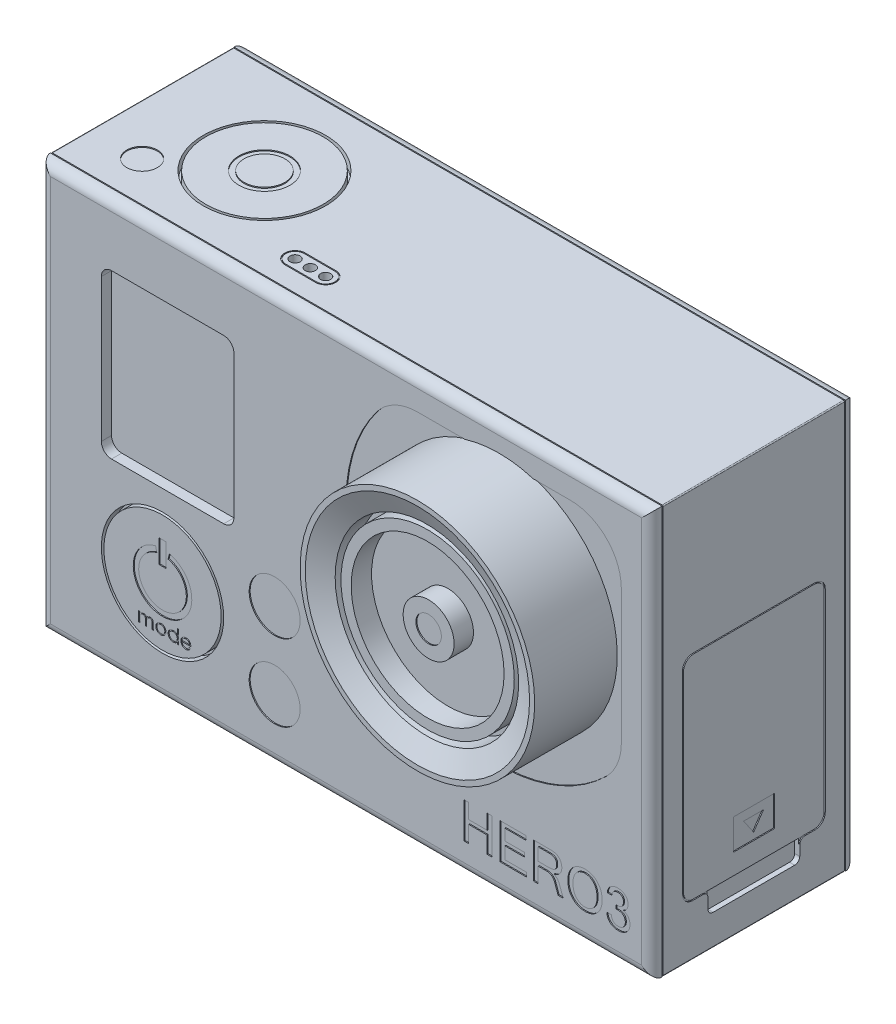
SolidWorks part; units mm, degrees
ref_plane "Plan de face" through (0, 0, 0) normal (0, 0, 1) x (1, 0, 0)
ref_plane "Plan de dessus" through (0, 0, 0) normal (0, 1, 0) x (1, 0, 0)
ref_plane "Plan de droite" through (0, 0, 0) normal (1, 0, 0) x (0, 0, -1)
sketch "Esquisse1" plane through (0, 0, 0) normal (0, 0, 1) x (1, 0, 0)
  line L1 (0, 0) -> (60, 0)
  line L2 (0, 0) -> (0, 40)
  line L3 (0, 40) -> (60, 40)
  line L4 (60, 0) -> (60, 40)
  dimension "D1" = 60
  dimension "D2" = 40
extrude "Extrusion1" add sketch "Esquisse1" along normal blind 20
sketch "Esquisse2" plane through (0, 0, 20) normal (0, 0, 1) x (1, 0, 0)
  line L0 (60, 0) -> (60, 40) construction
  line L1 (60, 0) -> (60, 40) construction
  line L2 (60, 40) -> (0, 40) construction
  circle A0 centre (45, 26) radius 11.5
  dimension "D1" = 23
  dimension "D2" = 15
  dimension "D3" = 14
extrude "Extrusion2" add sketch "Esquisse2" along normal blind 8
sketch "Esquisse3" plane through (0, 0, 20) normal (0, 0, 1) x (1, 0, 0)
  line L0 (0, 40) -> (0, 0) construction
  line L1 (6, 34) -> (19, 34)
  line L2 (6, 34) -> (6, 18)
  line L3 (6, 18) -> (19, 18)
  line L4 (19, 34) -> (19, 18)
  line L5 (60, 40) -> (0, 40) construction
  dimension "D1" = 13
  dimension "D2" = 16
  dimension "D3" = 6
  dimension "D4" = 6
extrude "Enlèv. mat.-Extru.1" cut sketch "Esquisse3" against normal blind 1
sketch "Esquisse4" plane through (0, 0, 20) normal (0, 0, 1) x (1, 0, 0)
  line L0 (0, 40) -> (0, 0) construction
  line L1 (0, 0) -> (60, 0) construction
  circle A0 centre (12, 10) radius 6
  circle A1 centre (12, 10) radius 5.75
  dimension "D1" = 12
  dimension "D2" = 11.5
  dimension "D3" = 12
  dimension "D4" = 10
extrude "Enlèv. mat.-Extru.2" cut sketch "Esquisse4" against normal blind 1
sketch "Esquisse5" plane through (0, 0, 20) normal (0, 0, 1) x (1, 0, 0)
  line L0 (0, 0) -> (60, 0) construction
  line L1 (0, 40) -> (0, 0) construction
  circle A0 centre (23, 13.5) radius 2.5
  circle A1 centre (23, 6) radius 2.5
  dimension "D1" = 5
  dimension "D2" = 5
  dimension "D4" = 23
  dimension "D6" = 7.5
  dimension "D3" = 6
  dimension "D5" = 23
extrude "Enlèv. mat.-Extru.3" cut sketch "Esquisse5" against normal blind 0.1
sketch "Esquisse6" plane through (0, 40, 0) normal (0, 1, 0) x (-1, 0, 0)
  line L0 (0, 20) -> (0, 0) construction
  line L1 (-60, 20) -> (0, 20) construction
  circle A0 centre (-12, 10) radius 5.75
  circle A1 centre (-12, 10) radius 6
  dimension "D1" = 11.5
  dimension "D2" = 12
  dimension "D3" = 12
  dimension "D4" = 10
extrude "Enlèv. mat.-Extru.4" cut sketch "Esquisse6" against normal blind 1
sketch "Esquisse7" plane through (0, 40, 0) normal (0, 1, 0) x (-1, 0, 0)
  circle A0 centre (-12, 10) radius 2.5
  circle A1 centre (-12, 10) radius 2
  dimension "D1" = 5
  dimension "D2" = 4
extrude "Enlèv. mat.-Extru.5" cut sketch "Esquisse7" against normal blind 0.1
sketch "Esquisse8" plane through (0, 0, 20) normal (0, 0, 1) x (1, 0, 0)
  line L0 (57, 37) -> (57, 17)
  line L1 (57, 37) -> (48.3541, 37)
  line L2 (60, 40) -> (0, 40) construction
  line L3 (60, 0) -> (60, 40) construction
  line L4 (41.6459, 37) -> (34.802, 37)
  arc A0 (34.802, 37) -> (57, 17) centre (45, 26) ccw
  circle A1 centre (45, 26) radius 11.5 construction
  arc A3 (41.6459, 37) -> (48.3541, 37) centre (45, 26) ccw
  dimension "D3" = 15
  dimension "D1" = 3
  dimension "D2" = 3
extrude "Enlèv. mat.-Extru.7" cut sketch "Esquisse8" against normal blind 0.1
sketch "Esquisse9" plane through (0, 0, 0) normal (-1, 0, 0) x (0, 0, 1)
  line L0 (0, 40) -> (0, 0) construction
  line L1 (20, 0) -> (0, 0) construction
  circle A0 centre (10, 10) radius 2.5
  circle A1 centre (10, 10) radius 2.25
  dimension "D1" = 5
  dimension "D2" = 4.5
  dimension "D3" = 10
  dimension "D4" = 10
extrude "Enlèv. mat.-Extru.8" cut sketch "Esquisse9" against normal blind 0.1
sketch "Esquisse10" plane through (0, 0, 0) normal (-1, 0, 0) x (0, 0, 1)
  line L0 (11, 21) -> (11, 18)
  line L1 (9, 21) -> (9, 18)
  line L2 (0, 40) -> (0, 0) construction
  line L3 (20, 0) -> (0, 0) construction
  line L4 (10.9, 21) -> (10.9, 18)
  line L5 (9.1, 21) -> (9.1, 18)
  arc A0 (11, 21) -> (9, 21) centre (10, 21) ccw
  arc A1 (9, 18) -> (11, 18) centre (10, 18) ccw
  arc A2 (9.1, 18) -> (10.9, 18) centre (10, 18) ccw
  arc A3 (10.9, 21) -> (9.1, 21) centre (10, 21) ccw
  dimension "D1" = 2
  dimension "D2" = 2
  dimension "D3" = 3
  dimension "D4" = 10
  dimension "D5" = 18
  dimension "D6" = 0.1
extrude "Enlèv. mat.-Extru.9" cut sketch "Esquisse10" against normal blind 0.1
sketch "Esquisse11" plane through (0, 0, 0) normal (-1, 0, 0) x (0, 0, 1)
  line L0 (10.9, 18) -> (10.9, 21) construction
  circle A0 centre (10, 18) radius 0.5
  circle A1 centre (10, 21) radius 0.5
  circle A2 centre (10, 19.5) radius 0.5
  dimension "D1" = 1
  dimension "D2" = 1
  dimension "D3" = 1
  dimension "D4" = 0.9
  dimension "D5" = 1.5
extrude "Enlèv. mat.-Extru.10" cut sketch "Esquisse11" against normal blind 1
sketch "Esquisse12" plane through (0, 0, 0) normal (-1, 0, 0) x (0, 0, 1)
  line L0 (0, 40) -> (0, 0) construction
  line L1 (0, 36) -> (4, 36)
  line L2 (0, 36) -> (0, 4)
  line L3 (0, 4) -> (4, 4)
  line L4 (4, 36) -> (4, 4)
  line L5 (20, 40) -> (0, 40) construction
  line L6 (20, 0) -> (0, 0) construction
  dimension "D1" = 4
  dimension "D2" = 4
  dimension "D3" = 4
extrude "Enlèv. mat.-Extru.11" cut sketch "Esquisse12" against normal blind 2
sketch "Esquisse13" plane through (2, 0, 0) normal (-1, 0, 0) x (0, 0, 1)
  line L0 (0, 4) -> (4, 4) construction
  line L1 (4, 36) -> (1, 36)
  line L2 (4, 36) -> (4, 4)
  line L3 (4, 4) -> (1, 4)
  line L4 (1, 36) -> (1, 4)
  dimension "D1" = 3
extrude "Enlèv. mat.-Extru.12" cut sketch "Esquisse13" against normal blind 2
sketch "Esquisse14" plane through (0, 40, 0) normal (0, 1, 0) x (-1, 0, 0)
  line L0 (0, 20) -> (0, 0) construction
  line L1 (-60, 20) -> (0, 20) construction
  circle A0 centre (-5, 15) radius 1.5
  dimension "D1" = 3
  dimension "D3" = 5
  dimension "D2" = 5
extrude "Enlèv. mat.-Extru.13" cut sketch "Esquisse14" against normal blind 0.1
sketch "Esquisse15" plane through (0, 0, 0) normal (-1, 0, 0) x (0, 0, 1)
  line L0 (10, 9) -> (10, 10) construction
  line L1 (9.5581, 9.4419) -> (9.4697, 9.5303)
  line L2 (10.4419, 9.4419) -> (10.5303, 9.5303)
  line L3 (9.0277, 9.9723) -> (8.9393, 10.0607)
  line L4 (10.9723, 9.9723) -> (11.0607, 10.0607)
  line L5 (11.5026, 10.5026) -> (11.591, 10.591)
  line L6 (8.4974, 10.5026) -> (8.409, 10.591)
  circle A0 centre (10, 9) radius 0.125
  arc A1 (10.4419, 9.4419) -> (9.5581, 9.4419) centre (10, 9) ccw
  arc A2 (10.5303, 9.5303) -> (9.4697, 9.5303) centre (10, 9) ccw
  arc A3 (10.9723, 9.9723) -> (9.0277, 9.9723) centre (10, 9) ccw
  arc A4 (11.0607, 10.0607) -> (8.9393, 10.0607) centre (10, 9) ccw
  arc A5 (11.5026, 10.5026) -> (8.4974, 10.5026) centre (10, 9) ccw
  arc A6 (11.591, 10.591) -> (8.409, 10.591) centre (10, 9) ccw
  dimension "D1" = 0.25
  dimension "D3" = 1.5
  dimension "D4" = 1.25
  dimension "D5" = 3
  dimension "D6" = 2.75
  dimension "D7" = 4.5
  dimension "D8" = 4.25
  dimension "D2" = 1
  dimension "D9" = 45
extrude "Enlèv. mat.-Extru.14" cut sketch "Esquisse15" against normal blind 0.1
sketch "Esquisse16" plane through (0, 40, 0) normal (0, 1, 0) x (-1, 0, 0)
  line L0 (-24, 17) -> (-21, 17)
  line L1 (-24, 15) -> (-21, 15)
  line L2 (-60, 20) -> (0, 20) construction
  line L3 (0, 20) -> (0, 0) construction
  line L4 (-24, 16.9) -> (-21, 16.9)
  line L5 (-24, 15.1) -> (-21, 15.1)
  arc A0 (-24, 17) -> (-24, 15) centre (-24, 16) ccw
  arc A1 (-21, 15) -> (-21, 17) centre (-21, 16) ccw
  arc A2 (-21, 15.1) -> (-21, 16.9) centre (-21, 16) ccw
  arc A3 (-24, 16.9) -> (-24, 15.1) centre (-24, 16) ccw
  dimension "D1" = 2
  dimension "D2" = 2
  dimension "D3" = 3
  dimension "D4" = 4
  dimension "D5" = 21
  dimension "D6" = 0.1
extrude "Enlèv. mat.-Extru.15" cut sketch "Esquisse16" against normal blind 0.1
sketch "Esquisse17" plane through (0, 40, 0) normal (0, 1, 0) x (-1, 0, 0)
  line L0 (-24, 16) -> (-22.5, 16) construction
  line L1 (-22.5, 16) -> (-22.5, 16.9) construction
  line L2 (-21, 16.9) -> (-24, 16.9) construction
  circle A0 centre (-24, 16) radius 0.5
  circle A1 centre (-21, 16) radius 0.5
  circle A2 centre (-22.5, 16) radius 0.5
  dimension "D1" = 1
  dimension "D2" = 1
  dimension "D3" = 1
extrude "Enlèv. mat.-Extru.16" cut sketch "Esquisse17" against normal blind 1
sketch "Esquisse18" plane through (0, 0, 28) normal (0, 0, 1) x (1, 0, 0)
  circle A0 centre (45, 26) radius 9
  dimension "D1" = 18
extrude "Enlèv. mat.-Extru.17" cut sketch "Esquisse18" against normal blind 3
sketch "Esquisse19" plane through (0, 0, 25) normal (0, 0, 1) x (1, 0, 0)
  circle A0 centre (45, 26) radius 8.5
  circle A1 centre (45, 26) radius 7.5
  dimension "D1" = 17
  dimension "D2" = 15
extrude "Extrusion3" add sketch "Esquisse19" along normal blind 2
sketch "Esquisse20" plane through (0, 0, 25) normal (0, 0, 1) x (1, 0, 0)
  circle A0 centre (45, 26) radius 2.5
  dimension "D1" = 5
extrude "Extrusion4" add sketch "Esquisse20" along normal blind 1.9
sketch "Esquisse21" plane through (0, 0, 26.9) normal (0, 0, 1) x (1, 0, 0)
  circle A0 centre (45, 26) radius 1.25
  dimension "D1" = 2.5
extrude "Enlèv. mat.-Extru.18" cut sketch "Esquisse21" against normal blind 0.1
sketch "Esquisse22" plane through (60, 0, 0) normal (1, 0, 0) x (0, 0, -1)
  line L0 (-20, 0) -> (0, 0) construction
  line L1 (-17, 26) -> (-3, 26)
  line L2 (-17, 26) -> (-17, 5)
  line L3 (-17, 5) -> (-3, 5)
  line L4 (-3, 26) -> (-3, 5)
  line L5 (-20, 0) -> (-20, 40) construction
  line L6 (-3.1, 25.9) -> (-3.1, 5.1)
  line L7 (-16.9, 5.1) -> (-3.1, 5.1)
  line L8 (-16.9, 25.9) -> (-16.9, 5.1)
  line L9 (-16.9, 25.9) -> (-3.1, 25.9)
  dimension "D1" = 14
  dimension "D2" = 21
  dimension "D3" = 5
  dimension "D4" = 3
  dimension "D5" = 0.1
extrude "Enlèv. mat.-Extru.19" cut sketch "Esquisse22" against normal blind 0.1
sketch "Esquisse23" plane through (60, 0, 0) normal (1, 0, 0) x (0, 0, -1)
  line L2 (-14.5, 5.1) -> (-14.5, 3)
  line L3 (-14.5, 3) -> (-5.5, 3)
  line L4 (-5.5, 5.1) -> (-5.5, 3)
  line L5 (-17, 26) -> (-17, 5) construction
  line L6 (-3, 5) -> (-3, 26) construction
  line L7 (-16.9, 5.1) -> (-3.1, 5.1) construction
  line L8 (-14.5, 5.1) -> (-5.5, 5.1)
  dimension "D2" = 2.5
  dimension "D3" = 2.5
extrude "Enlèv. mat.-Extru.20" cut sketch "Esquisse23" against normal blind 0.5
sketch "Esquisse24" plane through (60, 0, 0) normal (1, 0, 0) x (0, 0, -1)
  line L0 (-17, 26) -> (-17, 5) construction
  line L1 (-12, 10.1) -> (-8, 10.1)
  line L2 (-12, 10.1) -> (-12, 7.1)
  line L3 (-12, 7.1) -> (-8, 7.1)
  line L4 (-8, 10.1) -> (-8, 7.1)
  line L5 (-16.9, 5.1) -> (-3.1, 5.1) construction
  dimension "D1" = 4
  dimension "D2" = 5
  dimension "D3" = 3
  dimension "D4" = 2
extrude "Enlèv. mat.-Extru.21" cut sketch "Esquisse24" against normal blind 0.1
sketch "Esquisse25" plane through (59.9, 0, 0) normal (1, 0, 0) x (0, 0, -1)
  line L0 (-10.9074, 9.144) -> (-8.9511, 9.144)
  line L1 (-8.9511, 9.144) -> (-9.9293, 7.7213)
  line L2 (-9.9293, 7.7213) -> (-10.9074, 9.144)
extrude "Enlèv. mat.-Extru.22" cut sketch "Esquisse25" against normal blind 0.1
sketch "Esquisse26" plane through (60, 0, 0) normal (1, 0, 0) x (0, 0, -1)
  line L0 (-20, 40) -> (0, 40) construction
  line L1 (-19, 40) -> (-18.9, 40)
  line L2 (-19, 40) -> (-19, 0)
  line L3 (-19, 0) -> (-18.9, 0)
  line L4 (-18.9, 40) -> (-18.9, 0)
  line L5 (-20, 0) -> (0, 0) construction
  line L6 (0, 0) -> (0, 40) construction
  line L7 (-1, 40) -> (-1.1, 40)
  line L8 (-1, 40) -> (-1, 0)
  line L9 (-1, 0) -> (-1.1, 0)
  line L10 (-1.1, 40) -> (-1.1, 0)
  line L11 (-20, 0) -> (-20, 40) construction
  dimension "D1" = 0.1
  dimension "D2" = 0.1
  dimension "D3" = 1
  dimension "D4" = 1
extrude "Enlèv. mat.-Extru.23" cut sketch "Esquisse26" against normal blind 0.1
sketch "Esquisse27" plane through (0, 0, 0) normal (0, -1, 0) x (1, 0, 0)
  line L0 (0, 20) -> (0, 0) construction
  line L1 (59.9, 19) -> (0, 19)
  line L2 (59.9, 19) -> (59.9, 18.9)
  line L3 (59.9, 18.9) -> (0, 18.9)
  line L4 (0, 19) -> (0, 18.9)
  line L6 (59.9, 1.1) -> (0, 1.1)
  line L7 (59.9, 1.1) -> (59.9, 1)
  line L8 (59.9, 1) -> (0, 1)
  line L9 (0, 1.1) -> (0, 1)
  dimension "D1" = 0.1
  dimension "D2" = 0.1
extrude "Enlèv. mat.-Extru.24" cut sketch "Esquisse27" against normal blind 0.1
sketch "Esquisse28" plane through (0, 40, 0) normal (0, 1, 0) x (-1, 0, 0)
  line L0 (0, 20) -> (0, 0) construction
  line L1 (-59.9, 1.1) -> (0, 1.1)
  line L2 (-59.9, 1.1) -> (-59.9, 1)
  line L3 (-59.9, 1) -> (0, 1)
  line L4 (0, 1.1) -> (0, 1)
  line L5 (-59.9, 18.9) -> (0, 18.9)
  line L6 (-59.9, 18.9) -> (-59.9, 19)
  line L7 (-59.9, 19) -> (0, 19)
  line L8 (0, 18.9) -> (0, 19)
  dimension "D1" = 0.1
  dimension "D2" = 0.1
extrude "Enlèv. mat.-Extru.25" cut sketch "Esquisse28" against normal blind 0.1
sketch "Esquisse29" plane through (0, 0, 0) normal (-1, 0, 0) x (0, 0, 1)
  line L0 (18.9, 0) -> (1.1, 0) construction
  line L1 (18.9, 39.9) -> (19, 39.9)
  line L2 (18.9, 39.9) -> (18.9, 0)
  line L3 (18.9, 0) -> (19, 0)
  line L4 (19, 39.9) -> (19, 0)
  line L5 (1.1, 39.9) -> (1, 39.9)
  line L6 (1.1, 39.9) -> (1.1, 0)
  line L7 (1.1, 0) -> (1, 0)
  line L8 (1, 39.9) -> (1, 0)
  dimension "D1" = 0.1
  dimension "D2" = 0.1
extrude "Enlèv. mat.-Extru.26" cut sketch "Esquisse29" against normal blind 0.1
sketch "Esquisse30" plane through (0, 0, 0) normal (0, 0, -1) x (-1, 0, 0)
  line L0 (0, 40) -> (0, 36) construction
  line L1 (-35, 39) -> (-4, 39)
  line L2 (-35, 39) -> (-35, 1)
  line L3 (-35, 1) -> (-4, 1)
  line L4 (-4, 39) -> (-4, 1)
  line L5 (0, 4) -> (0, 36) construction
  line L6 (-60, 40) -> (0, 40) construction
  line L7 (0, 0) -> (-60, 0) construction
  line L8 (-4.1, 38.9) -> (-4.1, 1.1)
  line L9 (-34.9, 1.1) -> (-4.1, 1.1)
  line L10 (-34.9, 38.9) -> (-34.9, 1.1)
  line L11 (-34.9, 38.9) -> (-4.1, 38.9)
  dimension "D1" = 4
  dimension "D2" = 1
  dimension "D3" = 1
  dimension "D4" = 31
  dimension "D5" = 0.1
extrude "Enlèv. mat.-Extru.27" cut sketch "Esquisse30" against normal blind 0.5
sketch "Esquisse31" plane through (0, 0, 20) normal (0, 0, 1) x (1, 0, 0)
  line L0 (12, 10) -> (12, 11.3681) construction
  line L1 (11.6674, 13.6368) -> (12.3326, 13.6368)
  line L2 (11.6674, 13.6368) -> (11.6674, 11.3681)
  line L3 (11.6674, 11.3681) -> (12.3326, 11.3681)
  line L4 (12.3326, 13.6368) -> (12.3326, 11.3681)
  line L5 (12.5519, 12.2698) -> (12.6785, 12.7906)
  line L6 (11.4481, 12.2698) -> (11.3215, 12.7906)
  arc A0 (11.3215, 12.7906) -> (12.6785, 12.7906) centre (12, 10) ccw
  arc A1 (11.4481, 12.2698) -> (12.5519, 12.2698) centre (12, 10) ccw
extrude "Enlèv. mat.-Extru.28" cut sketch "Esquisse31" against normal blind 0.1
sketch "Esquisse32" plane through (0, 0, 20) normal (0, 0, 1) x (1, 0, 0)
  text T0 "mode" font "Century Gothic" height in points 5
extrude "Enlèv. mat.-Extru.29" cut sketch "Esquisse32" against normal blind 0.1
sketch "Esquisse33" plane through (0, 0, 20) normal (0, 0, 1) x (1, 0, 0)
  text T0 "HERO3" font "Microsoft Sans Serif" height 3.5
extrude "Enlèv. mat.-Extru.30" cut sketch "Esquisse33" against normal blind 0.1
sketch "Esquisse34" plane through (0, 0, 0) normal (0, 0, -1) x (-1, 0, 0)
  line L0 (-60, 40) -> (0, 40) construction
  line L1 (-43, 26) -> (-37, 26)
  line L2 (-43, 26) -> (-43, 14)
  line L3 (-43, 14) -> (-37, 14)
  line L4 (-37, 26) -> (-37, 14)
  line L5 (-35, 39) -> (-35, 1) construction
  dimension "D1" = 6
  dimension "D2" = 12
  dimension "D3" = 14
  dimension "D4" = 2
extrude "Enlèv. mat.-Extru.31" cut sketch "Esquisse34" against normal blind 0.5
sketch "Esquisse35" plane through (0, 0, 0.5) normal (0, 0, -1) x (-1, 0, 0)
  line L0 (-37, 26) -> (-43, 26) construction
  line L1 (-37.1, 25.9) -> (-41.6, 25.9)
  line L2 (-37.1, 25.9) -> (-37.1, 14.1)
  line L3 (-37.1, 14.1) -> (-41.6, 14.1)
  line L4 (-41.6, 25.9) -> (-41.6, 14.1)
  line L5 (-37, 14) -> (-37, 26) construction
  line L6 (-43, 14) -> (-37, 14) construction
  dimension "D1" = 0.1
  dimension "D2" = 0.1
  dimension "D3" = 0.1
  dimension "D4" = 4.5
extrude "Extrusion5" add sketch "Esquisse35" along normal blind 0.5
sketch "Esquisse36" plane through (0, 0, 0) normal (0, 0, -1) x (-1, 0, 0)
  line L0 (-37.1, 14.1) -> (-37.1, 25.9) construction
  line L1 (-40.6, 25.5) -> (-37.3, 25.5)
  line L2 (-40.6, 25.5) -> (-40.6, 14.5)
  line L3 (-40.6, 14.5) -> (-37.3, 14.5)
  line L4 (-37.3, 25.5) -> (-37.3, 14.5)
  line L5 (-37.1, 25.9) -> (-41.6, 25.9) construction
  line L6 (-41.6, 14.1) -> (-37.1, 14.1) construction
  line L7 (-41.6, 25.9) -> (-41.6, 14.1) construction
  dimension "D1" = 0.2
  dimension "D2" = 0.4
  dimension "D3" = 0.4
  dimension "D4" = 1
extrude "Enlèv. mat.-Extru.32" cut sketch "Esquisse36" against normal blind 0.5
sketch "Esquisse37" plane through (0, 0, 0) normal (0, -1, 0) x (1, 0, 0)
  line L0 (56.5, 19.9) -> (33.5, 19.9) construction
  line L1 (60, 18.9) -> (60, 1.1) construction
  circle A0 centre (53, 4.9) radius 1.5
  dimension "D1" = 3
  dimension "D3" = 7
  dimension "D2" = 15
extrude "Enlèv. mat.-Extru.33" cut sketch "Esquisse37" against normal blind 0.1
sketch "Esquisse38" plane through (0, 0, 0) normal (0, 0, -1) x (-1, 0, 0)
  line L0 (-60, 40) -> (0, 40) construction
  line L1 (-57, 30) -> (-55, 30)
  line L2 (-57, 30) -> (-57, 10)
  line L3 (-57, 10) -> (-55, 10)
  line L4 (-55, 30) -> (-55, 10)
  line L5 (0, 0) -> (-60, 0) construction
  line L6 (-60, 0) -> (-60, 40) construction
  dimension "D1" = 2
  dimension "D2" = 10
  dimension "D3" = 10
  dimension "D4" = 3
extrude "Enlèv. mat.-Extru.34" cut sketch "Esquisse38" against normal blind 2
sketch "Esquisse39" plane through (0, 0, 2) normal (0, 0, -1) x (-1, 0, 0)
  line L0 (-55, 10) -> (-55, 30) construction
  line L1 (-55.5, 27.5) -> (-56, 27.5)
  line L2 (-55.5, 27.5) -> (-55.5, 12.5)
  line L3 (-55.5, 12.5) -> (-56, 12.5)
  line L4 (-56, 27.5) -> (-56, 12.5)
  line L5 (-55, 30) -> (-57, 30) construction
  line L6 (-57, 10) -> (-55, 10) construction
  dimension "D1" = 0.5
  dimension "D2" = 0.5
  dimension "D3" = 2.5
  dimension "D4" = 2.5
extrude "Extrusion6" add sketch "Esquisse39" along normal blind 1.5
sketch "Esquisse40" plane through (0, 0, 0) normal (0, 0, -1) x (-1, 0, 0)
  line L0 (-60, 0) -> (-60, 40) construction
  line L1 (-60, 40) -> (0, 40) construction
  circle A0 centre (-56, 34) radius 1.5
  dimension "D1" = 3
  dimension "D3" = 6
  dimension "D2" = 4
extrude "Enlèv. mat.-Extru.35" cut sketch "Esquisse40" against normal blind 0.1
fillet "Congé1" radius 1 9 edges at (30, 0, 0) (0, 2, 0) (0, 38, 0) (60, 20, 0) (30, 40, 0) (30, 0, 20) (60, 20, 20) (30, 40, 20) (0, 20, 20)
fillet "Congé2" radius 1 4 edges at (6, 34, 19.5) (6, 18, 19.5) (19, 34, 19.5) (19, 18, 19.5)
fillet "Congé3" radius 5 3 edges at (57, 17, 19.95) (34.802, 37, 19.95) (57, 37, 19.95)
fillet "Congé4" radius 0.5 4 edges at (59.95, 5, 5.5) (59.75, 3, 5.5) (59.75, 3, 14.5) (59.95, 5, 14.5)
fillet "Congé5" radius 1 4 edges at (59.95, 5.1, 16.9) (59.95, 5.1, 3.1) (59.95, 25.9, 3.1) (59.95, 25.9, 16.9)
fillet "Congé6" radius 1 4 edges at (59.95, 5, 17) (59.95, 26, 17) (59.95, 26, 3) (59.95, 5, 3)
fillet "Congé8" radius 0.1 4 edges at (0, 40, 10) (0, 0, 10) (60, 40, 10) (60, 0, 10)
fillet "Congé9" radius 0.5 4 edges at (38.95, 25.5, 0.5) (37.3, 20, 0.5) (38.95, 14.5, 0.5) (40.6, 20, 0.5)
chamfer "Chanfrein1" distance 2 angle 25 1 edges at (54, 26, 28)
